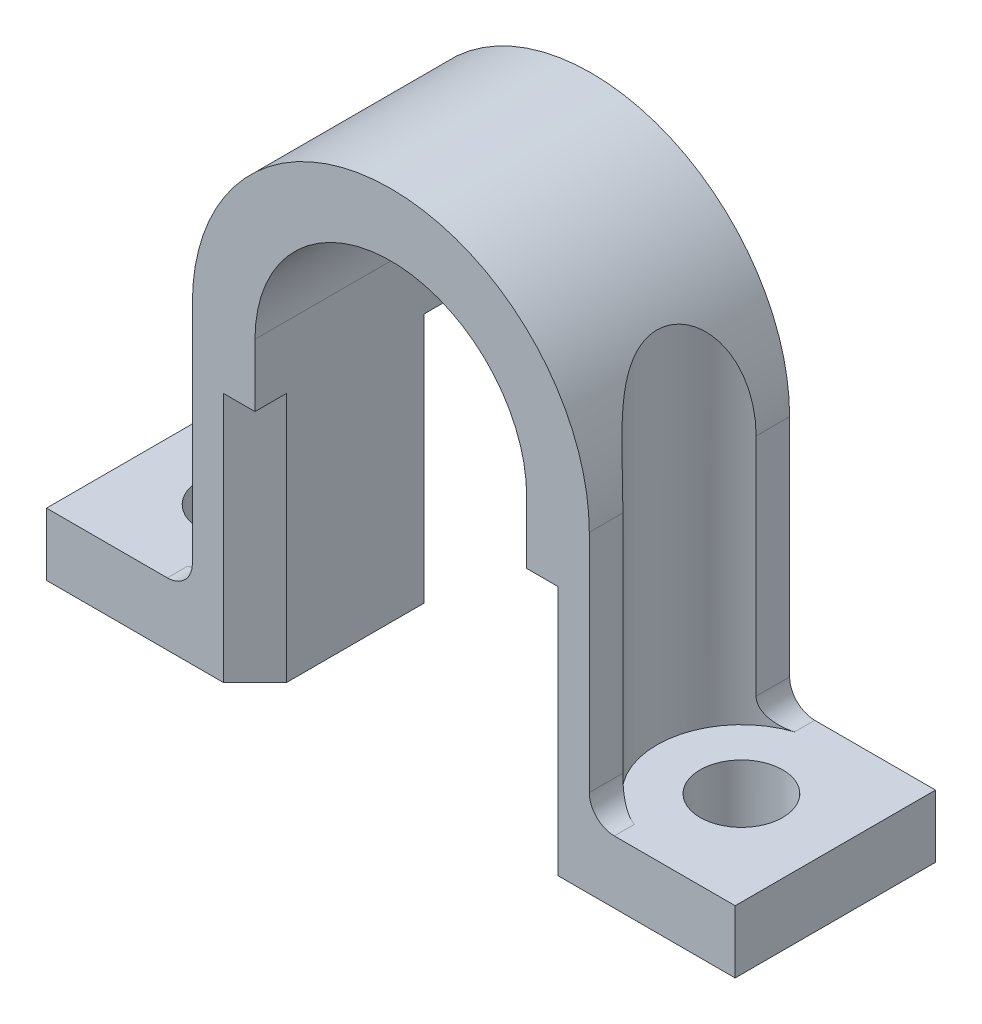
SolidWorks part; units mm, degrees
other "<socket head cap screw 4762_din>-<Hex>"
ref_plane "Ebene vorne" through (0, 0, 0) normal (0, 0, 1) x (1, 0, 0)
ref_plane "Ebene oben" through (0, 0, 0) normal (0, 1, 0) x (1, 0, 0)
ref_plane "Ebene rechts" through (0, 0, 0) normal (1, 0, 0) x (0, 0, -1)
sketch "Skizze1" plane through (0, 0, 0) normal (0, 0, 1) x (1, 0, 0)
  line L0 (0, 0) -> (0, 25) construction
  line L1 (27.5, 0) -> (-27.5, 0)
  line L2 (-27.5, 0) -> (-27.5, 5)
  line L3 (-27.5, 5) -> (-15.85, 5)
  line L4 (-15.85, 25) -> (-15.85, 5)
  line L5 (-10.85, 25) -> (-10.85, 0)
  line L6 (27.5, 5) -> (15.85, 5)
  line L7 (27.5, 0) -> (27.5, 5)
  line L8 (10.85, 25) -> (10.85, 0)
  line L9 (15.85, 25) -> (15.85, 5)
  circle A0 centre (0, 25) radius 10.85
  arc A1 (15.85, 25) -> (-15.85, 25) centre (0, 25) ccw
  circle A2 centre (0, 25) radius 15.85 construction
  dimension "D2" = 21.7
  dimension "D3" = 25
  dimension "D1" = 55
  dimension "D5" = 5
  dimension "D4" = 5
extrude "Aufsatz-Linear austragen1" add sketch "Skizze1" along normal blind 16 contours L9 A1 L4 L3 L2 L1 L5 A0 L8 L7 L6
sketch "Skizze2" plane through (0, 0, 0) normal (0, -1, 0) x (-1, 0, 0)
  line L0 (27.5, -8) -> (-27.5, -8) construction
  line L1 (27.5, -16) -> (27.5, 0) construction
  line L2 (-27.5, -16) -> (-27.5, 0) construction
  line L3 (0, -8) -> (0, -16) construction
  line L4 (-10.85, -16) -> (10.85, -16) construction
  circle A0 centre (20, -8) radius 3.3
  circle A1 centre (-20, -8) radius 3.3
  dimension "D2" = 6.6
  dimension "D1" = 40
extrude "Schnitt-Linear austragen1" cut sketch "Skizze2" against normal up to next
fillet "Verrundung1" radius 2 2 edges at (15.85, 5, 8) (-15.85, 5, 8)
sketch "Skizze3" plane through (0, 5, 0) normal (0, 1, 0) x (1, 0, 0)
  line L0 (0, 0) -> (0, -18.4) construction
  circle A1 centre (-20, -8) radius 6.75
  circle A2 centre (20, -8) radius 6.75
  dimension "D1" = 13.5
extrude "Schnitt-Linear austragen2" cut sketch "Skizze3" along normal through all
sketch "Skizze4" plane through (0, 0, 0) normal (0, -1, 0) x (1, 0, 0)
  line L0 (0, 0) -> (0, 16) construction
  line L1 (10.85, 16) -> (-10.85, 16) construction
  line L2 (0, 8) -> (-27.5, 8) construction
  line L3 (-27.5, 16) -> (-27.5, 0) construction
  line L4 (-10.85, 16) -> (-13.35, 16)
  line L5 (-10.85, 16) -> (-27.5, 16) construction
  line L6 (-13.35, 16) -> (-10.85, 13.5)
  line L7 (-10.85, 16) -> (-10.85, 0) construction
  line L8 (-10.85, 13.5) -> (-10.85, 16)
  line L9 (13.35, 16) -> (10.85, 13.5)
  line L10 (10.85, 16) -> (13.35, 16)
  line L11 (10.85, 13.5) -> (10.85, 16)
  line L12 (10.85, 0) -> (13.35, 0)
  line L13 (10.85, 2.5) -> (10.85, 0)
  line L14 (13.35, 0) -> (10.85, 2.5)
  line L15 (-13.35, 0) -> (-10.85, 2.5)
  line L16 (-10.85, 0) -> (-13.35, 0)
  line L17 (-10.85, 2.5) -> (-10.85, 0)
  dimension "D1" = 2.5
extrude "Schnitt-Linear austragen3" cut sketch "Skizze4" against normal blind 20
inserted part "socket head cap screw 4762_din"
move or copy body "Körper-Verschieben/Kopieren2"
